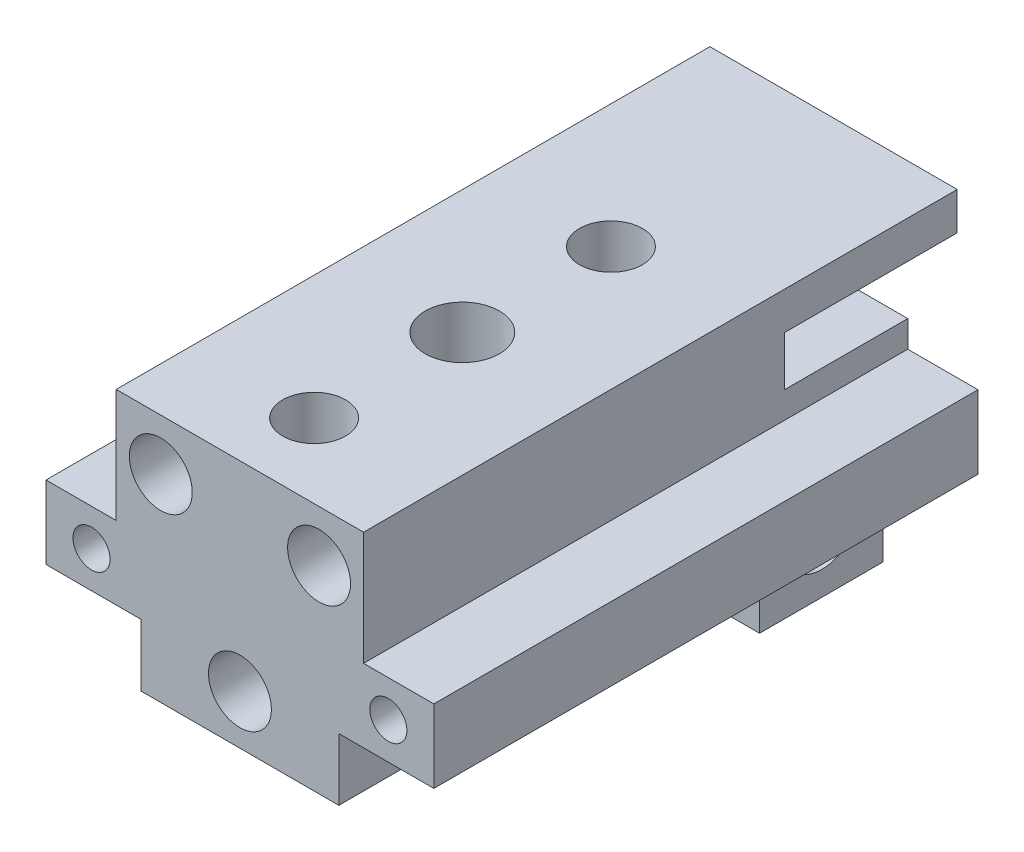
SolidWorks part; units mm, degrees
ref_plane "Front/Back" through (0, 0, 0) normal (0, 0, 1) x (1, 0, 0)
ref_plane "Top/Bottom" through (0, 0, 0) normal (0, 1, 0) x (1, 0, 0)
ref_plane "Right/Left" through (0, 0, 0) normal (1, 0, 0) x (0, 0, -1)
sketch "Sketch1" plane through (0, 0, 0) normal (0, 1, 0) x (1, 0, 0)
  line L0 (0, 0) -> (12.446, 0) construction
  line L1 (-12.446, 19.05) -> (12.446, 19.05)
  line L2 (-12.446, 19.05) -> (-12.446, -19.05)
  line L3 (-12.446, -19.05) -> (12.446, -19.05)
  line L4 (12.446, 19.05) -> (12.446, -19.05)
  line L5 (0, 0) -> (0, 19.05) construction
  dimension "D1" = 24.892
  dimension "D2" = 38.1
extrude "Extrude1" add sketch "Sketch1" along normal mid plane 19.9136
sketch "Sketch2" plane through (0, 0, 19.05) normal (0, 0, 1) x (1, 0, 0)
  line L0 (5.7996, 0.3175) -> (13.285, 0.3175) construction
  line L1 (0, 0) -> (0, 10.6257) construction
  line L3 (-12.446, 9.9568) -> (-7.9375, 9.9568)
  line L4 (-12.446, 9.9568) -> (-12.446, 2.667)
  line L5 (-12.446, 2.667) -> (-7.9375, 2.667)
  line L6 (-7.9375, 9.9568) -> (-7.9375, 2.667)
  line L7 (12.446, 9.9568) -> (7.9375, 9.9568)
  line L8 (12.446, 9.9568) -> (12.446, 2.667)
  line L9 (12.446, 2.667) -> (7.9375, 2.667)
  line L10 (7.9375, 9.9568) -> (7.9375, 2.667)
  line L11 (12.446, -9.9568) -> (6.35, -9.9568)
  line L12 (12.446, -9.9568) -> (12.446, -2.032)
  line L13 (12.446, -2.032) -> (6.35, -2.032)
  line L14 (6.35, -9.9568) -> (6.35, -2.032)
  line L15 (-12.446, -9.9568) -> (-6.35, -9.9568)
  line L16 (-12.446, -9.9568) -> (-12.446, -2.032)
  line L17 (-12.446, -2.032) -> (-6.35, -2.032)
  line L18 (-6.35, -9.9568) -> (-6.35, -2.032)
  dimension "D1" = 15.875
  dimension "D2" = 12.7
  dimension "D3" = 7.9248
  dimension "D4" = 4.699
  dimension "D5" = 9.6393
extrude "Cut-Extrude1" cut sketch "Sketch2" against normal through all
hole_wizard "#10-32 (Finger Mount Holes)" positions "Sketch4" profile "Sketch3" tap size "#10-32" standard "ANSI Inch"
sketch "Sketch4" plane through (0, 0, 19.05) normal (0, 0, 1) x (1, 0, 0)
  line L1 (0, 0) -> (0, 10.4799) construction
  line L3 (0, 0) -> (0, -10.3705) construction
  line L4 (12.446, 0.3175) -> (3.5391, 0.3175) construction
  line L5 (12.446, 2.667) -> (12.446, -2.032) construction
  point P0 (-5.08, 6.6675)
  point P1 (5.08, 6.6675)
  point P2 (0, -2.8575)
  point P22 (5.6884, 3.4651)
  dimension "D1" = 10.16
  dimension "D2" = 9.525
  dimension "D4" = 6.35
sketch "Sketch3" plane through (-5.08, 6.6675, 19.05) normal (1, 0, 0) x (0, -1, 0)
  line L0 (0, 0) -> (0, 14.8272)
  line L1 (0, 14.8272) -> (2.0193, 13.6139)
  line L2 (2.0193, 13.6139) -> (2.0193, 0)
  line L5 (2.0193, 0) -> (0, 0)
  line L10 (0, 14.8272) -> (-2.0193, 13.6139) construction
  line L11 (0, -6.35) -> (0, 107.95) construction
  dimension "Tap Drill Dia." = 4.0386
  dimension "Tap Drill Depth" = 13.6139
  dimension "Drill Angle" = 118
hole_wizard "(3/32 Dowel Holes - Slip Fit)" positions "Sketch7" profile "Sketch6" legacy
sketch "Sketch7" plane through (0, 0, 19.05) normal (0, 0, 1) x (1, 0, 0)
  line L1 (0, 0) -> (0, 10.5892) construction
  line L2 (-7.9375, 9.9568) -> (7.9375, 9.9568) construction
  line L3 (12.446, 0.3175) -> (-12.446, 0.3175) construction
  line L4 (12.446, 2.667) -> (12.446, -2.032) construction
  line L5 (-12.446, 2.667) -> (-12.446, -2.032) construction
  point P0 (9.525, 0.3175)
  point P1 (-9.525, 0.3175)
  dimension "D1" = 19.05
  dimension "D2" = 9.6393
sketch "Sketch6" plane through (9.525, 0.3175, 19.05) normal (1, 0, 0) x (0, -1, 0)
  line L0 (0, 0) -> (0, 7.0654)
  line L1 (0, 7.0654) -> (1.1906, 6.35)
  line L2 (1.1906, 6.35) -> (1.1906, 0)
  line L4 (1.1906, 0) -> (0, 0)
  line L6 (0, 7.0654) -> (-1.1906, 6.35) construction
  line L7 (0, -4.2442) -> (0, 117.3081) construction
  dimension "Diameter" = 2.3813
  dimension "Depth" = 6.35
  dimension "Drill Angle" = 118
sketch "Sketch8" plane through (0, 0, 19.05) normal (0, 0, 1) x (1, 0, 0)
  line L0 (6.35, -2.032) -> (6.35, -9.9568) construction
  line L1 (-6.35, -9.9568) -> (6.35, -9.9568)
  line L2 (-6.35, -9.9568) -> (-6.35, -6.0198)
  line L3 (-6.35, -6.0198) -> (6.35, -6.0198)
  line L4 (6.35, -9.9568) -> (6.35, -6.0198)
  dimension "D1" = 3.937
extrude "Cut-Extrude2" cut sketch "Sketch8" against normal blind 27.0002
sketch "Sketch9" plane through (0, 0, -19.05) normal (0, 0, -1) x (-1, 0, 0)
  line L0 (-7.9375, 7.5438) -> (7.9375, 7.5438)
  line L1 (-7.9375, 9.9568) -> (7.9375, 9.9568) construction
  line L12 (6.35, -9.9568) -> (6.35, -2.032)
  line L13 (6.35, -2.032) -> (12.446, -2.032)
  line L14 (12.446, -2.032) -> (12.446, 2.667)
  line L15 (12.446, 2.667) -> (7.9375, 2.667)
  line L16 (7.9375, 2.667) -> (7.9375, 9.9568)
  line L17 (7.9375, 9.9568) -> (-7.9375, 9.9568)
  line L18 (-7.9375, 9.9568) -> (-7.9375, 2.667)
  line L19 (-7.9375, 2.667) -> (-12.446, 2.667)
  line L20 (-12.446, 2.667) -> (-12.446, -2.032)
  line L21 (-12.446, -2.032) -> (-6.35, -2.032)
  line L22 (-6.35, -2.032) -> (-6.35, -9.9568)
  line L23 (-6.35, -9.9568) -> (6.35, -9.9568)
  line L24 (6.35, -9.9568) -> (6.35, -2.032)
  line L25 (6.35, -2.032) -> (12.446, -2.032)
  line L26 (12.446, -2.032) -> (12.446, 2.667)
  line L27 (12.446, 2.667) -> (7.9375, 2.667)
  line L28 (7.9375, 2.667) -> (7.9375, 7.5438)
  line L30 (-7.9375, 7.5438) -> (-7.9375, 2.667)
  line L31 (-7.9375, 2.667) -> (-12.446, 2.667)
  line L32 (-12.446, 2.667) -> (-12.446, -2.032)
  line L33 (-12.446, -2.032) -> (-6.35, -2.032)
  line L34 (-6.35, -2.032) -> (-6.35, -9.9568)
  line L35 (-6.35, -9.9568) -> (6.35, -9.9568)
  dimension "D2" = 2.413
  dimension "D1" = 0
extrude "Cut-Extrude3" cut sketch "Sketch9" against normal blind 3.175
sketch "Sketch10" plane through (6.35, 0, 0) normal (1, 0, 0) x (0, 0, -1)
  line L0 (15.875, -2.032) -> (15.875, -9.9568) construction
  line L1 (19.05, 9.9568) -> (-19.05, 9.9568) construction
  circle A0 centre (11.938, -6.0198) radius 2.3876
  dimension "D1" = 4.7752
  dimension "D2" = 3.937
  dimension "D3" = 15.9766
extrude "Cut-Extrude4" cut sketch "Sketch10" against normal through all
sketch "Sketch11" plane through (7.9375, 0, 0) normal (1, 0, 0) x (0, 0, -1)
  line L1 (15.875, 7.5438) -> (7.9502, 7.5438)
  line L2 (15.875, 7.5438) -> (15.875, 4.3688)
  line L3 (15.875, 4.3688) -> (7.9502, 4.3688)
  line L4 (7.9502, 7.5438) -> (7.9502, 4.3688)
  dimension "D1" = 3.175
  dimension "D2" = 7.9248
extrude "Cut-Extrude5" cut sketch "Sketch11" against normal through all
sketch "Sketch12" plane through (0, 0, -15.875) normal (0, 0, -1) x (-1, 0, 0)
  line L0 (-6.35, -9.9568) -> (6.35, -9.9568) construction
  line L1 (-3.302, -9.9568) -> (3.302, -9.9568)
  line L2 (-3.302, -9.9568) -> (-3.302, -2.032)
  line L3 (-3.302, -2.032) -> (3.302, -2.032)
  line L4 (3.302, -9.9568) -> (3.302, -2.032)
  line L5 (0, 0) -> (0, 10.6621) construction
  line L6 (0, 0) -> (14.362, 0) construction
  dimension "D1" = 7.9248
  dimension "D2" = 6.604
extrude "Cut-Extrude6" cut sketch "Sketch12" against normal offset from surface (22.225 mm away) 12.7
hole_wizard "#10-32 Tapped Hole2" positions "Sketch14" profile "Sketch13" tap size "#10-32" standard "ANSI Inch"
sketch "Sketch14" plane through (0, 9.9568, 0) normal (0, 1, 0) x (-1, 0, 0)
  line L0 (0, 0) -> (15.7617, 0) construction
  line L1 (0, 0) -> (0, 20.539) construction
  line L2 (0, 5.4361) -> (0, 6.35) construction
  line L3 (7.9375, 19.05) -> (-7.9375, 19.05) construction
  point P0 (0, 14.2875)
  point P1 (0, -4.7625)
  dimension "D1" = 19.05
  dimension "D2" = 4.7625
sketch "Sketch13" plane through (0, 9.9568, 14.2875) normal (1, 0, 0) x (0, 0, 1)
  line L0 (0, 0) -> (0, 14.8272)
  line L1 (0, 14.8272) -> (2.0193, 13.6139)
  line L2 (2.0193, 13.6139) -> (2.0193, 0)
  line L5 (2.0193, 0) -> (0, 0)
  line L10 (0, 14.8272) -> (-2.0193, 13.6139) construction
  line L11 (0, -6.35) -> (0, 107.95) construction
  dimension "Tap Drill Dia." = 4.0386
  dimension "Tap Drill Depth" = 13.6139
  dimension "Drill Angle" = 118
hole_wizard "(3/16 Dowel Hole - Slip Fit)" positions "Sketch16" profile "Sketch15" legacy
sketch "Sketch16" plane through (0, 9.9568, 0) normal (0, 1, 0) x (-1, 0, 0)
  line L0 (0, 0) -> (16.0406, 0) construction
  line L1 (0, 0) -> (0, 20.0508) construction
  line L2 (7.9375, 19.05) -> (-7.9375, 19.05) construction
  point P0 (0, 4.7752)
  dimension "D1" = 14.2748
sketch "Sketch15" plane through (0, 9.9568, 4.7752) normal (1, 0, 0) x (0, 0, 1)
  line L0 (0, 0) -> (0, 7.9248)
  line L1 (0, 7.9248) -> (2.3813, 7.9248)
  line L2 (2.3813, 7.9248) -> (2.3813, 0)
  line L3 (2.3813, 0) -> (0, 0)
  line L4 (0, 110) -> (0, -10) construction
  dimension "Diameter" = 4.7625
  dimension "Depth" = 7.9248
